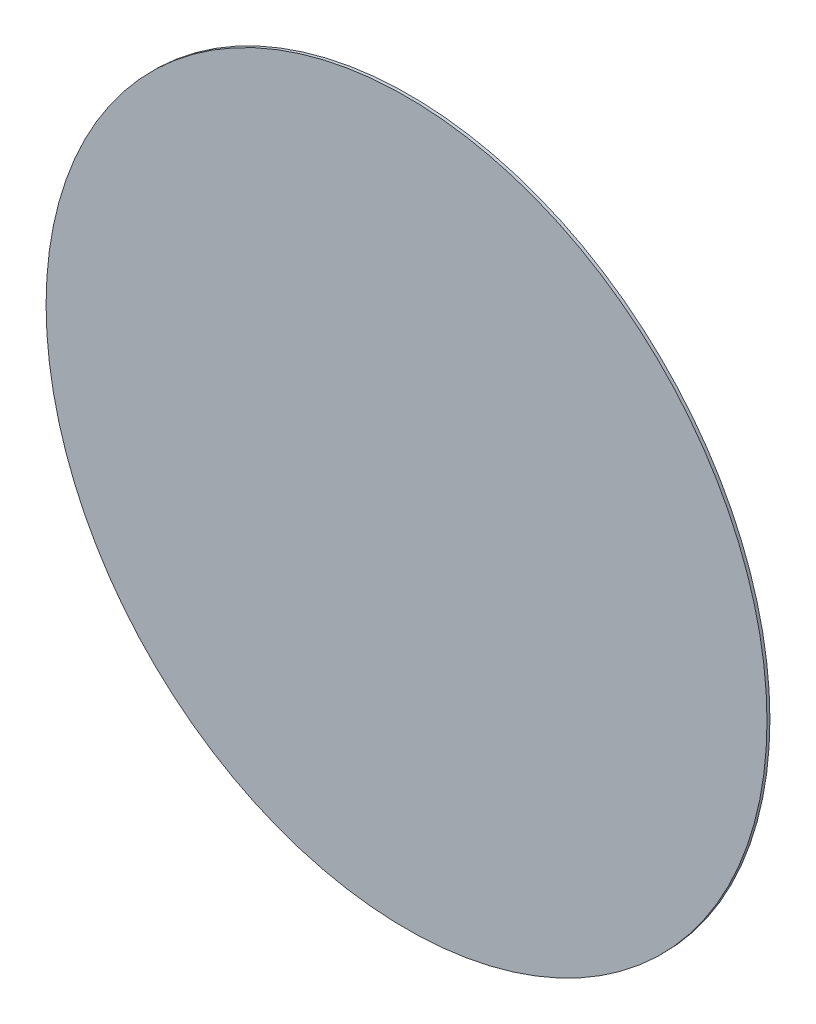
SolidWorks part; units mm, degrees
ref_plane "Front" through (0, 0, 0) normal (0, 0, 1) x (1, 0, 0)
ref_plane "Top" through (0, 0, 0) normal (0, 1, 0) x (1, 0, 0)
ref_plane "Right" through (0, 0, 0) normal (1, 0, 0) x (0, 0, -1)
sketch "Sketch1" plane through (0, 0, 0) normal (0, 0, 1) x (1, 0, 0)
  circle A0 centre (0, 0) radius 12.5
  dimension "D1" = 25
extrude "Extrude1" add sketch "Sketch1" along normal blind 0.1016
